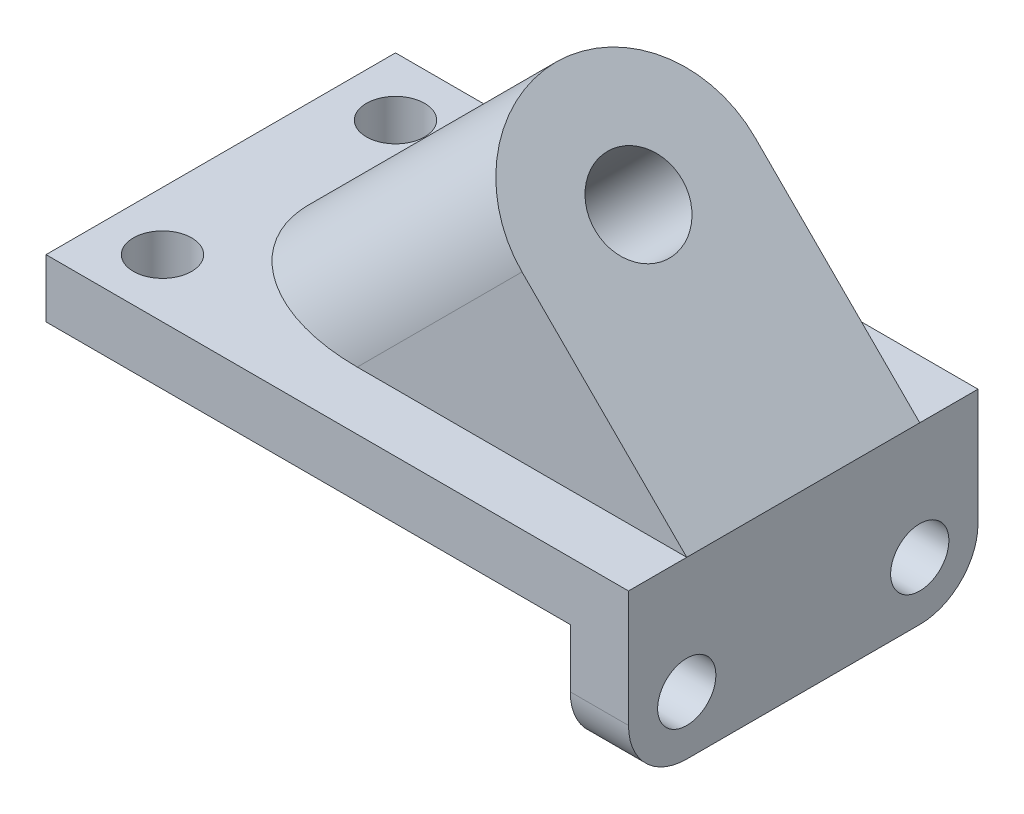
SolidWorks part; units mm, degrees
ref_plane "Front Plane" through (0, 0, 0) normal (0, 0, 1) x (1, 0, 0)
ref_plane "Top Plane" through (0, 0, 0) normal (0, 1, 0) x (1, 0, 0)
ref_plane "Right Plane" through (0, 0, 0) normal (1, 0, 0) x (0, 0, -1)
sketch "Sketch1" plane through (0, 0, 0) normal (0, 1, 0) x (1, 0, 0)
  line L1 (0, 0) -> (127, 0)
  line L2 (0, 0) -> (0, 76.2)
  line L3 (0, 76.2) -> (127, 76.2)
  line L4 (127, 0) -> (127, 76.2)
  line L5 (0, 0) -> (127, 76.2) construction
  line L6 (0, 76.2) -> (127, 0) construction
  circle A0 centre (12.7, 12.7) radius 6.35
  circle A1 centre (12.7, 63.5) radius 6.35
  point P4 (63.5, 38.1)
  dimension "D1" = 12.7
  dimension "D4" = 50.8
  dimension "D2" = 76.2
  dimension "D6" = 12.7
  dimension "D3" = 12.7
  dimension "D5" = 127
  dimension "D7" = 12.7
  dimension "D8" = 12.7
extrude "Boss-Extrude1" add sketch "Sketch1" against normal blind 12.7
sketch "Sketch7" plane through (127, 0, 0) normal (1, 0, 0) x (0, 0, -1)
  line L0 (0, 0) -> (76.2, 0) construction
  line L1 (0, 0) -> (76.2, 0)
  line L2 (0, 0) -> (0, -25.4)
  line L3 (12.7, -38.1) -> (63.5, -38.1)
  line L4 (76.2, 0) -> (76.2, -25.4)
  line L5 (0, 0) -> (76.2, -38.1) construction
  line L6 (0, -38.1) -> (76.2, 0) construction
  circle A0 centre (12.7, -25.4) radius 6.35
  circle A1 centre (63.5, -25.4) radius 6.35
  arc A2 (63.5, -38.1) -> (76.2, -25.4) centre (63.5, -25.4) ccw
  arc A3 (0, -25.4) -> (12.7, -38.1) centre (12.7, -25.4) ccw
  point P4 (38.1, -19.05)
  dimension "D1" = 12.7
  dimension "D2" = 12.7
  dimension "D5" = 12.7
  dimension "D6" = 12.7
  dimension "D3" = 38.1
  dimension "D4" = 25.4
  dimension "D7" = 38.1
  dimension "D9" = 76.2
extrude "Boss-Extrude5" add sketch "Sketch7" against normal blind 12.7
ref_plane "Plane1" through (63.5, 63.5, 0) normal (0.7071, 0.7071, 0) x (0, 0, -1)
sketch "Sketch9" plane through (63.5, 63.5, 0) normal (0.7071, 0.7071, 0) x (0, 0, -1)
  line L0 (12.7, -89.8026) -> (63.5, -89.8026)
  line L1 (0, -89.8026) -> (76.2, -89.8026) construction
  line L5 (63.5, -89.8026) -> (63.5, -39.0026)
  line L6 (12.7, -89.8026) -> (12.7, -39.0026)
  arc A0 (12.7, -39.0026) -> (63.5, -39.0026) centre (38.1, -39.0026) cw
  point P0 (0, 0)
  point P1 (0, 0)
  dimension "D1" = 12.7
  dimension "D3" = 25.4
extrude "Boss-Extrude9" add sketch "Sketch9" against normal up to surface contours L0 L5 A0 L6
sketch "Sketch13" plane through (63.5, 63.5, 0) normal (0.7071, 0.7071, 0) x (0, 0, -1)
  line L0 (12.7, -89.8026) -> (63.5, -89.8026) construction
  circle A0 centre (38.1, -39.0026) radius 9.525
  point P0 (38.1, -39.0026)
  dimension "D1" = 50.8
  dimension "D2" = 19.05
  dimension "D3" = 38.1
extrude "Cut-Extrude1" cut sketch "Sketch13" against normal blind 101.6
